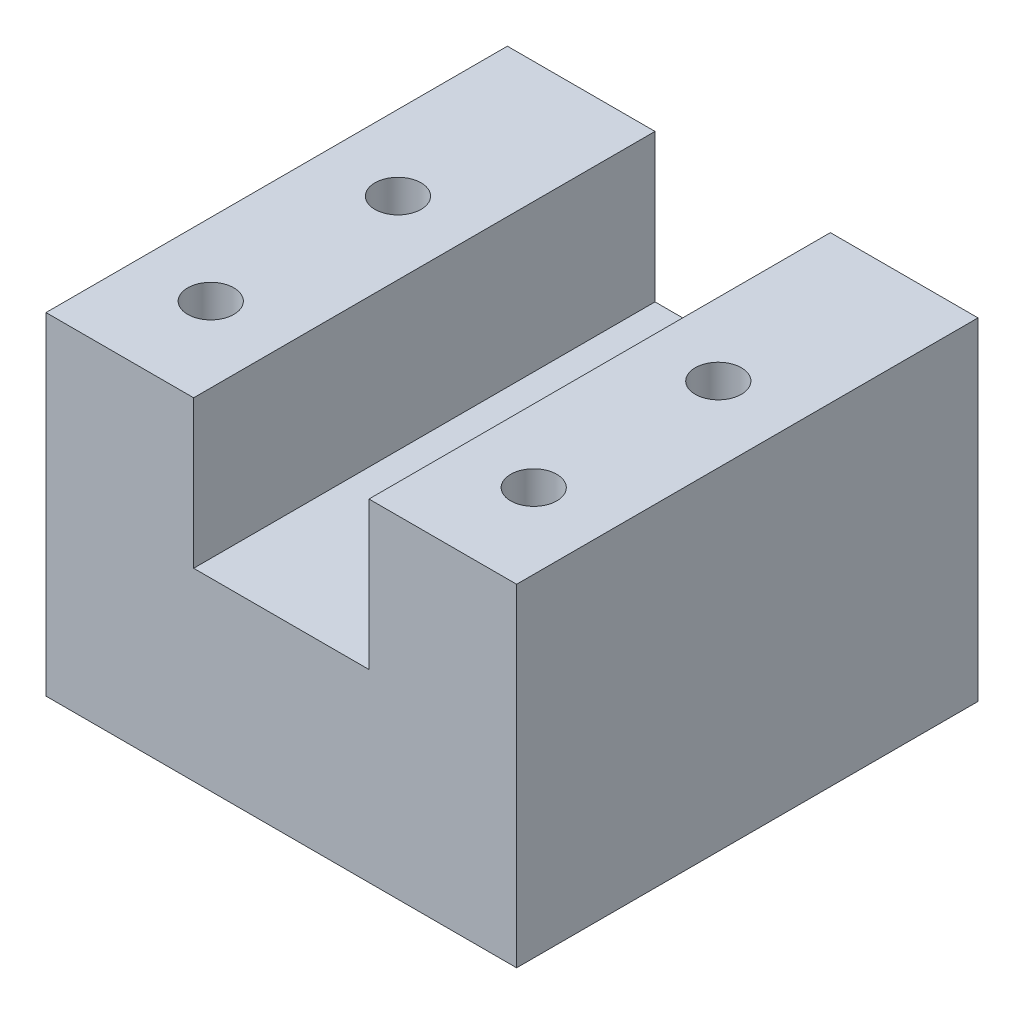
SolidWorks part; units mm, degrees
ref_plane "前视基准面" through (0, 0, 0) normal (0, 0, 1) x (1, 0, 0)
ref_plane "上视基准面" through (0, 0, 0) normal (0, 1, 0) x (1, 0, 0)
ref_plane "右视基准面" through (0, 0, 0) normal (1, 0, 0) x (0, 0, -1)
sketch "草图2" plane through (0, 0, 0) normal (0, 0, 1) x (1, 0, 0)
  line L0 (8, 10) -> (8, 18)
  line L1 (17.5, 10) -> (17.5, 18)
  line L2 (0, 0) -> (25.5, 0)
  line L3 (8, 10) -> (17.5, 10)
  line L4 (0, 18) -> (8, 18)
  line L5 (25.5, 0) -> (25.5, 18)
  line L6 (0, 0) -> (0, 18)
  line L7 (17.5, 18) -> (25.5, 18)
extrude "凸台-拉伸1" add sketch "草图2" along normal blind 25
sketch "草图3" plane through (0, 18, 0) normal (0, 1, 0) x (1, 0, 0)
  line L0 (12.75, 0) -> (12.75, -25) construction
  line L1 (17.5, 0) -> (8, 0) construction
  line L2 (17.5, -25) -> (8, -25) construction
  circle A0 centre (3.9281, -20) radius 1.25
  circle A1 centre (21.4281, -10) radius 1.25
  circle A2 centre (21.4281, -20) radius 1.25
  circle A3 centre (4.0719, -10) radius 1.25
extrude "切除-拉伸1" cut sketch "草图3" against normal blind 12
sketch "草图4" plane through (0, 18, 0) normal (0, 1, 0) x (1, 0, 0)
  circle A0 centre (3.9281, -20) radius 1.25
  circle A1 centre (21.4281, -10) radius 1.25
  circle A2 centre (21.4281, -20) radius 1.25
  circle A3 centre (3.9281, -15) radius 1.65 construction
  circle A4 centre (21.4281, -15) radius 1.65 construction
  text T0 "M3" font "TXT" height 0.4838
sketch "草图5" plane through (0, 0, 0) normal (0, -1, 0) x (1, 0, 0)
  circle A0 centre (3.9281, 15) radius 1.65
  circle A1 centre (21.4281, 15) radius 1.6611
extrude "切除-拉伸2" cut sketch "草图5" against normal blind 12
sketch "草图6" plane through (0, 10, 0) normal (0, 1, 0) x (1, 0, 0)
  circle A0 centre (12.6781, -6.5) radius 2
extrude "切除-拉伸3" cut sketch "草图6" against normal blind 12
